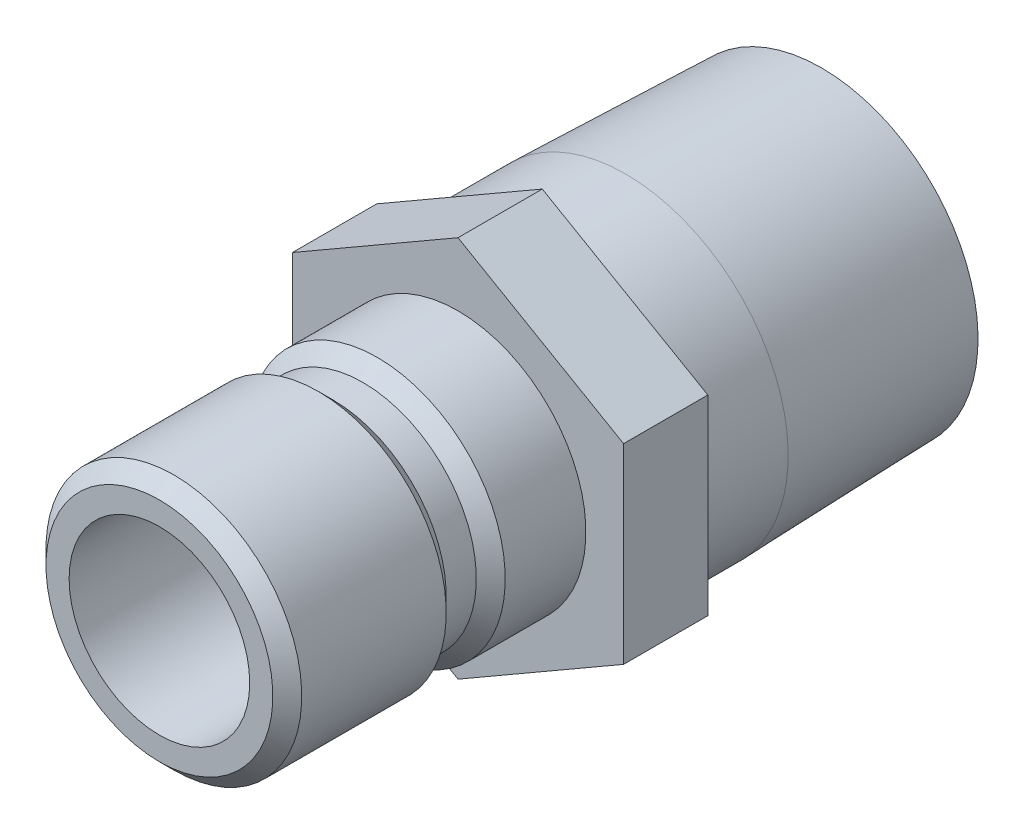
SolidWorks part; units mm, degrees
ref_plane "Front Plane" through (0, 0, 0) normal (0, 0, 1) x (1, 0, 0)
ref_plane "Top Plane" through (0, 0, 0) normal (0, 1, 0) x (1, 0, 0)
ref_plane "Right Plane" through (0, 0, 0) normal (1, 0, 0) x (0, 0, -1)
sketch "Sketch1" plane through (0, 0, 0) normal (1, 0, 0) x (0, 0, -1)
  line L0 (0, 0) -> (-18.923, 0) construction
  line L1 (-15.748, 4.7625) -> (-15.748, 5.9817)
  line L2 (-6.604, 5.9817) -> (-6.604, 0) construction
  line L3 (-14.986, 6.7437) -> (-7.366, 6.7437)
  line L4 (0, 8.5725) -> (0, 0) construction
  line L5 (-6.604, 5.9817) -> (-5.0165, 5.9817)
  line L6 (-4.2545, 6.7437) -> (0, 6.7437)
  line L7 (0, 6.7437) -> (0, 8.5725)
  line L8 (-6.604, 5.9817) -> (-7.366, 6.7437)
  line L9 (-5.0165, 5.9817) -> (-4.2545, 6.7437)
  line L10 (-15.748, 5.9817) -> (-14.986, 6.7437)
  line L11 (-15.748, 4.7625) -> (0.127, 4.7625)
  line L12 (0, 8.5725) -> (8.8392, 8.5725)
  line L13 (8.8392, 8.5725) -> (19.177, 8.2494)
  line L14 (19.177, 8.2494) -> (19.177, 6.2611)
  line L15 (0, 0) -> (4.445, 0) construction
  line L17 (0.9238, 6.2611) -> (19.177, 6.2611)
  line L18 (0.127, 4.7625) -> (0.9238, 6.2611)
  dimension "D1" = 15.748
  dimension "D2" = 1.5875
  dimension "D3" = 0.762
  dimension "D4" = 45
  dimension "D5" = 9.144
  dimension "D6" = 45
  dimension "D7" = 1.79
  dimension "D8" = 10.3378
  dimension "D9" = 34.925
  dimension "D10" = 3.175
  dimension "D11" = 9.525
  dimension "D12" = 17.145
  dimension "D13" = 4.445
  dimension "D14" = 13.4874
  dimension "D15" = 12.5222
  dimension "D16" = 15.875
  dimension "D17" = 118
revolve "Revolve1" add sketch "Sketch1" angle 360 about L0
sketch "Sketch2" plane through (0, 0, 0) normal (0, 0, 1) x (1, 0, 0)
  line L1 (-8.7313, 5.041) -> (-8.7313, -5.041)
  line L2 (-8.7313, -5.041) -> (0, -10.082)
  line L3 (0, -10.082) -> (8.7312, -5.041)
  line L4 (8.7312, -5.041) -> (8.7312, 5.041)
  line L5 (8.7312, 5.041) -> (0, 10.082)
  line L6 (0, 10.082) -> (-8.7313, 5.041)
  circle A0 centre (0, 0) radius 8.7313 construction
  circle A1 centre (0, 0) radius 6.2611 construction
  circle A2 centre (0, 0) radius 6.2611
  dimension "D1" = 17.4625
extrude "Boss-Extrude1" add sketch "Sketch2" against normal up to vertex (4.445 mm away)
